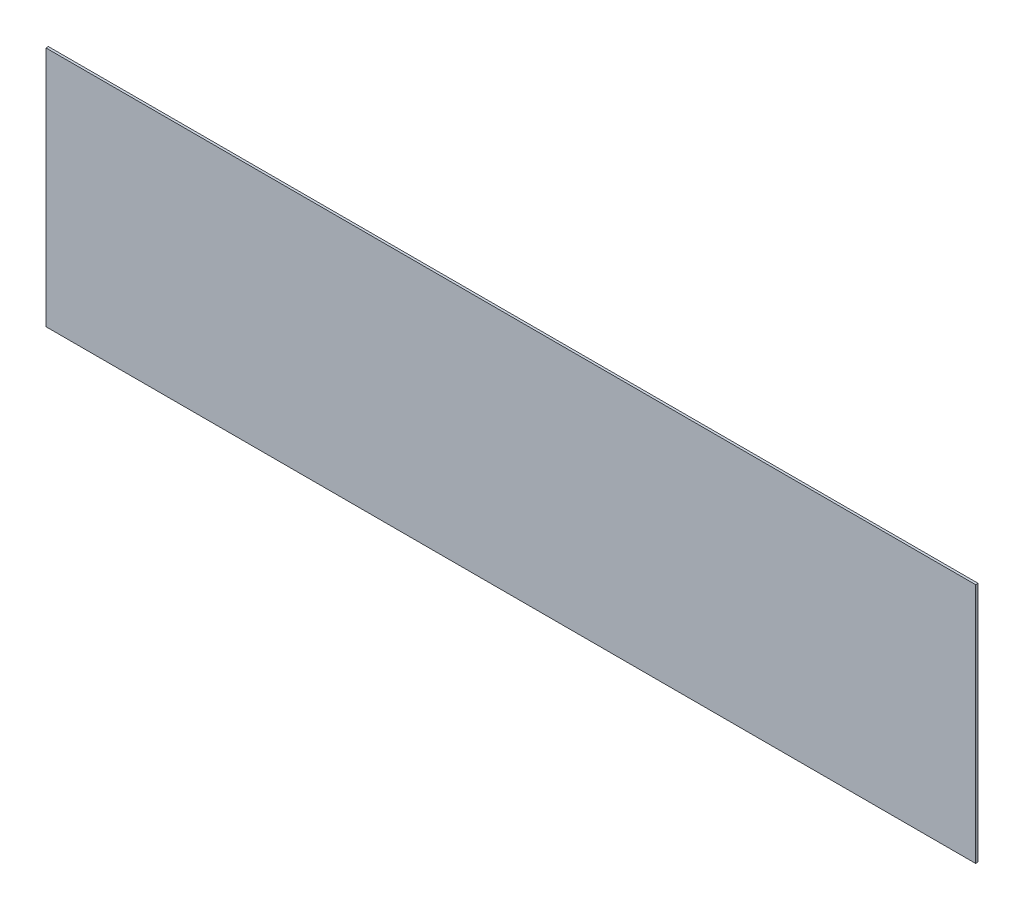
SolidWorks part; units mm, degrees
ref_plane "Piano frontale" through (0, 0, 0) normal (0, 0, 1) x (1, 0, 0)
ref_plane "Piano superiore" through (0, 0, 0) normal (0, 1, 0) x (1, 0, 0)
ref_plane "Piano destro" through (0, 0, 0) normal (1, 0, 0) x (0, 0, -1)
sketch "Schizzo1" plane through (0, 0, 0) normal (0, 0, 1) x (1, 0, 0)
  line L1 (-385, -100) -> (385, -100)
  line L2 (-385, -100) -> (-385, 100)
  line L3 (-385, 100) -> (385, 100)
  line L4 (385, -100) -> (385, 100)
  line L5 (-385, -100) -> (385, 100) construction
  line L6 (-385, 100) -> (385, -100) construction
  point P0 (0, 0)
  dimension "D1" = 770
  dimension "D2" = 200
extrude "Estrusione-Estrusione1" add sketch "Schizzo1" along normal blind 2
